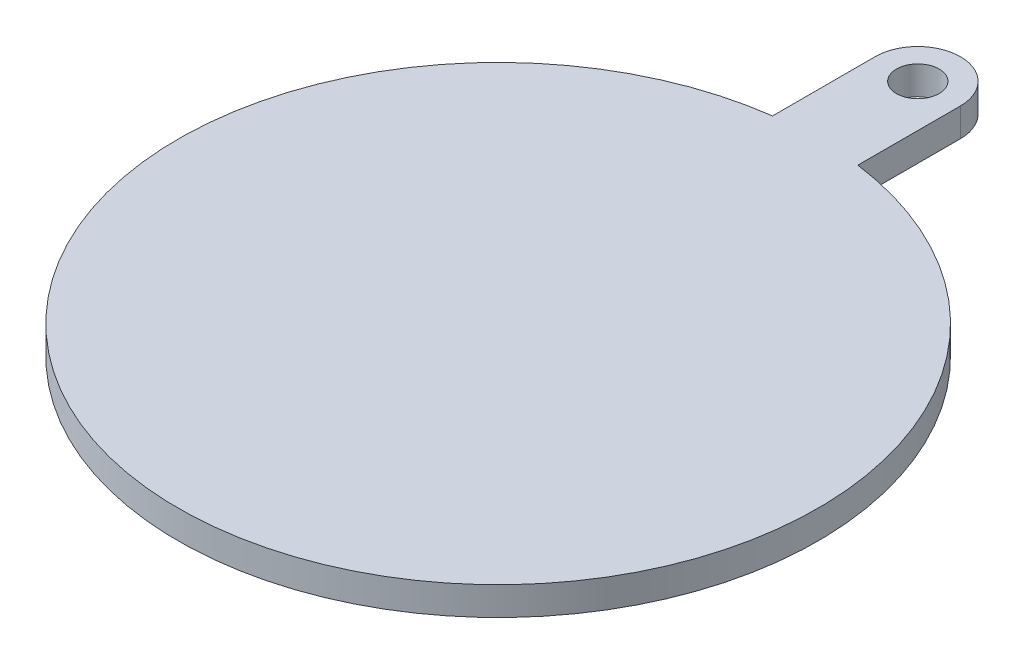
SolidWorks part; units mm, degrees
ref_plane "Front" through (0, 0, 0) normal (0, 0, 1) x (1, 0, 0)
ref_plane "Top" through (0, 0, 0) normal (0, 1, 0) x (1, 0, 0)
ref_plane "Right" through (0, 0, 0) normal (1, 0, 0) x (0, 0, -1)
sketch "草图1" plane through (0, 0, 0) normal (0, 1, 0) x (1, 0, 0)
  line L0 (0, 29.5163) -> (0, 0)
  line L1 (-3, 29.5163) -> (-3, 0)
  line L2 (3, 29.5163) -> (3, 0)
  circle A0 centre (0, 0) radius 22.5
  circle A1 centre (0, 29.5163) radius 3
  circle A2 centre (0, 29.5163) radius 1.5
  dimension "D1" = 45
  dimension "D4" = 6
  dimension "D5" = 3
  dimension "D2" = 3
  dimension "D3" = 3
extrude "凸台-拉伸1" add sketch "草图1" along normal blind 2
